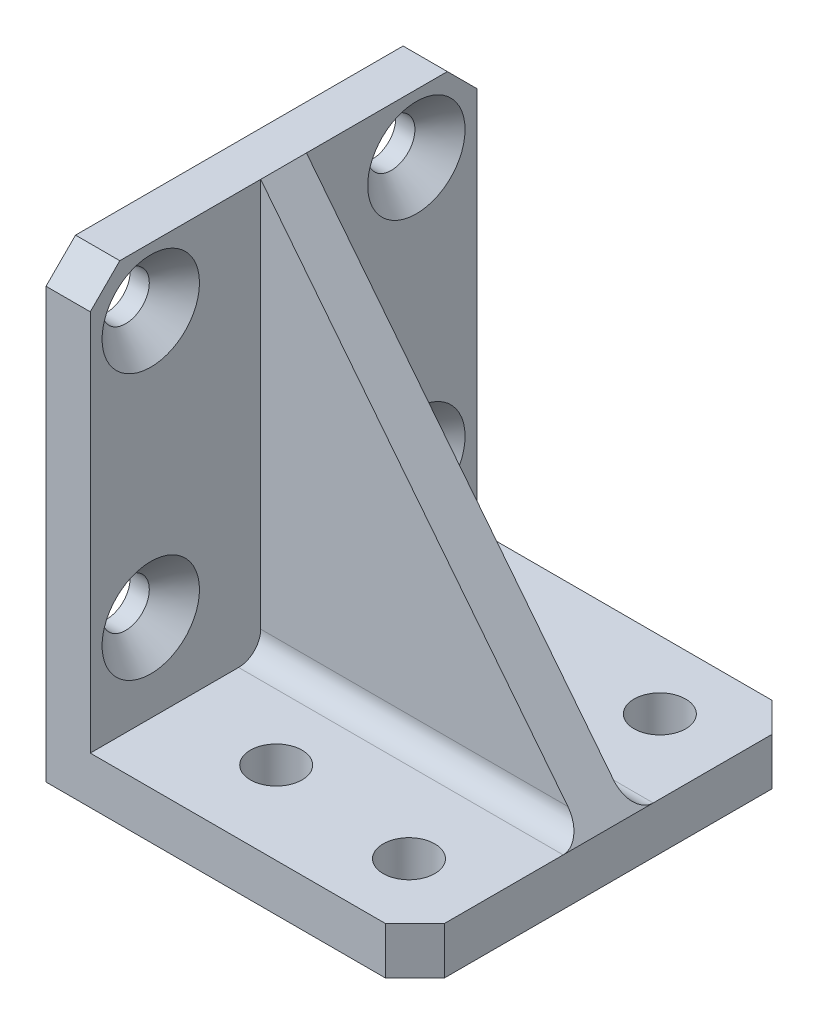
SolidWorks part; units mm, degrees
ref_plane "前视基准面" through (0, 0, 0) normal (0, 0, 1) x (1, 0, 0)
ref_plane "上视基准面" through (0, 0, 0) normal (0, 1, 0) x (1, 0, 0)
ref_plane "右视基准面" through (0, 0, 0) normal (1, 0, 0) x (0, 0, -1)
sketch "草图1" plane through (0, 0, 0) normal (0, 0, 1) x (1, 0, 0)
  line L0 (0, 0) -> (25, 0)
  line L1 (25, 0) -> (25, 3.2)
  line L2 (25, 3.2) -> (3, 3.2)
  line L3 (3, 3.2) -> (3, 31.1)
  line L4 (3, 31.1) -> (0, 31.1)
  line L5 (0, 31.1) -> (0, 0)
  dimension "D1" = 25
  dimension "D2" = 31.1
  dimension "D3" = 3.2
  dimension "D4" = 3
extrude "凸台-拉伸1" add sketch "草图1" along normal mid plane 26.2
sketch "草图4" plane through (0, 0, 0) normal (0, -1, 0) x (1, 0, 0)
  line L0 (0, 0) -> (32.0267, 0) construction
  circle A0 centre (10, -7.5) radius 1.75
  circle A1 centre (10, 7.5) radius 1.75
  circle A2 centre (20, 8.5) radius 1.75
  circle A3 centre (20, -8.5) radius 1.75
  dimension "D1" = 15
  dimension "D2" = 3.5
  dimension "D3" = 10
  dimension "D4" = 17
  dimension "D5" = 20
extrude "切除-拉伸1" cut sketch "草图4" against normal up to surface (3.2 mm away)
sketch "草图5" plane through (0, 0, 0) normal (-1, 0, 0) x (0, 0, 1)
  line L0 (13.1, 31.1) -> (-13.1, 31.1) construction
  line L1 (0, 0) -> (0, 31.7857) construction
  circle A0 centre (-9, 27.1) radius 1.6
  circle A1 centre (9, 27.1) radius 1.6
  circle A2 centre (-9, 9.1) radius 1.6
  circle A3 centre (9, 9.1) radius 1.6
  dimension "D2" = 3.2
  dimension "D1" = 4
  dimension "D3" = 9
  dimension "D4" = 18
extrude "切除-拉伸2" cut sketch "草图5" against normal up to next
sketch "草图2" plane through (0, 0, 0) normal (0, 0, 1) x (1, 0, 0)
  line L0 (3, 31.1) -> (3, 3.2)
  line L1 (3, 3.2) -> (25, 3.2)
  line L2 (25, 3.2) -> (3, 31.1)
extrude "凸台-拉伸2" add sketch "草图2" along normal mid plane 3.1
chamfer "倒角1" distance 2 angle 45 4 edges at (1.5, 31.1, 13.1) (1.5, 31.1, -13.1) (25, 1.6, -13.1) (25, 1.6, 13.1)
fillet "圆角1" radius 1.5 2 edges at (14, 3.2, -1.55) (14, 3.2, 1.55)
hole_wizard "打孔尺寸(%根据十字)槽沉头木螺钉的类型1" positions "3D草图1" profile "草图6" countersink size "M3" standard "GB"
sketch3d "3D草图1"
  line L0 (3, 9.1, 9) -> (0, 9.1, 9) construction
  line L1 (3, 9.1, -9) -> (0, 9.1, -9) construction
  line L2 (3, 27.1, -9) -> (0, 27.1, -9) construction
  line L3 (3, 27.1, 9) -> (0, 27.1, 9) construction
  point P0 (3, 9.1, -9)
  point P2 (3, 27.1, 9)
  point P4 (3, 27.1, -9)
  point P6 (3, 9.1, 9)
sketch "草图6" plane through (3, 9.1, -9) normal (0, 1, 0) x (0, 0, -1)
  line L0 (0, 0) -> (0, 3)
  line L1 (0, 3) -> (1.6, 3)
  line L2 (1.6, 3) -> (1.6, 1.7)
  line L3 (1.6, 1.7) -> (3.3, 0)
  line L5 (3.3, 0) -> (0, 0)
  line L6 (-1.6, 1.7) -> (-3.3, 0) construction
  line L11 (0, -6.35) -> (0, 107.95) construction
  dimension "通孔孔直径" = 3.2
  dimension "通孔孔深度" = 3
  dimension "近端锥形沉头孔直径" = 6.6
  dimension "近端锥形沉头孔角度" = 90
